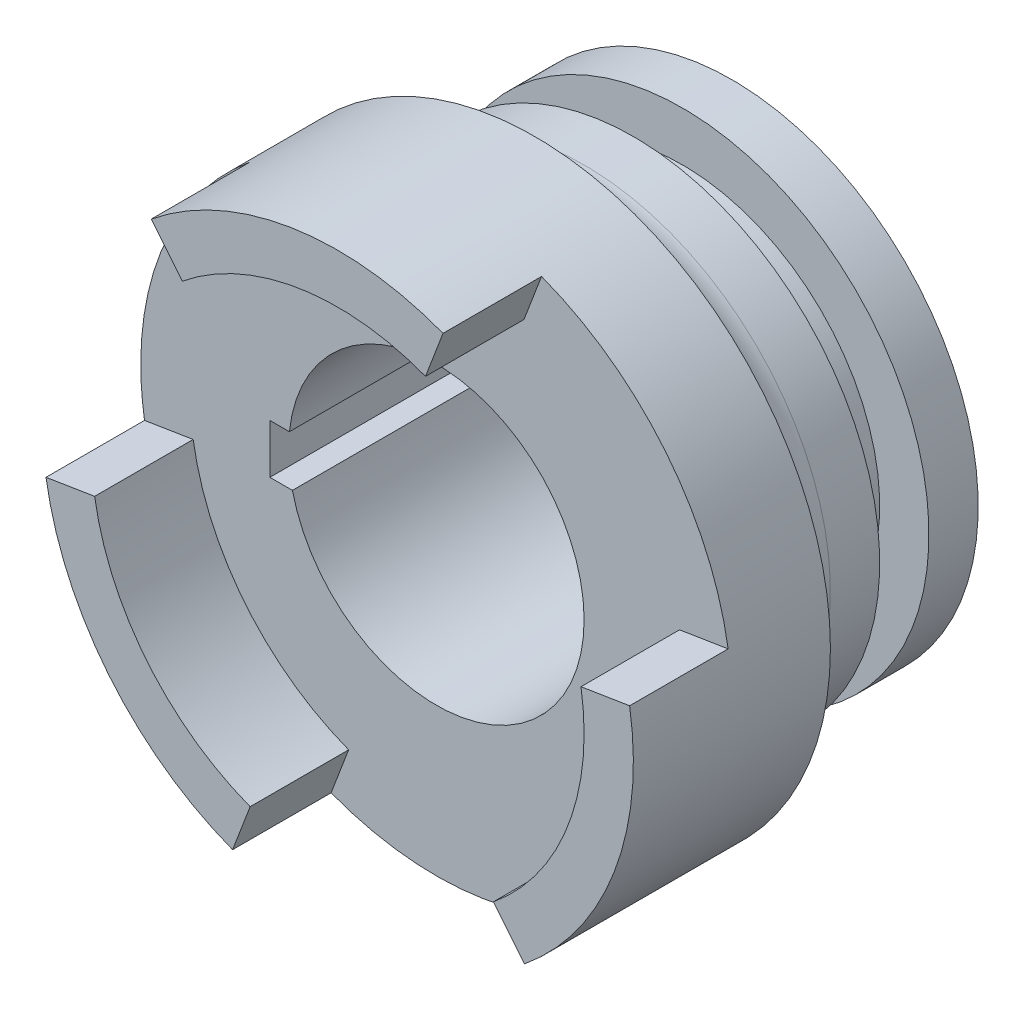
SolidWorks part; units mm, degrees
ref_plane "Front Plane" through (0, 0, 0) normal (0, 0, 1) x (1, 0, 0)
ref_plane "Top Plane" through (0, 0, 0) normal (0, 1, 0) x (1, 0, 0)
ref_plane "Right Plane" through (0, 0, 0) normal (1, 0, 0) x (0, 0, -1)
sketch "Sketch1" plane through (0, 0, 0) normal (0, 0, 1) x (1, 0, 0)
  line L0 (0, 0) -> (-18.9392, 23.266) construction
  line L1 (0, 0) -> (10.6793, 28.0348) construction
  line L2 (-18.9392, 23.266) -> (-15.7827, 19.3883)
  line L3 (10.6793, 28.0348) -> (8.8994, 23.3624)
  line L4 (29.6185, 4.7689) -> (24.6821, 3.974)
  line L5 (18.9392, -23.266) -> (15.7827, -19.3883)
  line L6 (-10.6793, -28.0348) -> (-8.8994, -23.3624)
  line L7 (-29.6185, -4.7689) -> (-24.6821, -3.974)
  arc A0 (10.6793, 28.0348) -> (-18.9392, 23.266) centre (0, 0) ccw
  circle A1 centre (0, 0) radius 25 construction
  arc A2 (-15.7827, 19.3883) -> (8.8994, 23.3624) centre (0, 0) cw
  circle A3 centre (0, 0) radius 30 construction
  arc A4 (24.6821, 3.974) -> (15.7827, -19.3883) centre (0, 0) cw
  arc A5 (18.9392, -23.266) -> (29.6185, 4.7689) centre (0, 0) ccw
  arc A6 (-8.8994, -23.3624) -> (-24.6821, -3.974) centre (0, 0) cw
  arc A7 (-29.6185, -4.7689) -> (-10.6793, -28.0348) centre (0, 0) ccw
  point P21 (0, 0)
  dimension "D1" = 60
  dimension "D3" = 60
  dimension "D2" = 5
  dimension "D4" = 3
extrude "Boss-Extrude1" add sketch "Sketch1" along normal blind 10
sketch "Sketch2" plane through (0, 0, 0) normal (0, 0, -1) x (-1, 0, 0)
  circle A0 centre (0, 0) radius 30
  dimension "D1" = 60
extrude "Boss-Extrude2" add sketch "Sketch2" along normal blind 10
sketch "Sketch3" plane through (0, 0, -10) normal (0, 0, -1) x (-1, 0, 0)
  circle A0 centre (0, 0) radius 25
  dimension "D1" = 50
extrude "Boss-Extrude3" add sketch "Sketch3" along normal blind 10
fillet "Fillet1" radius 5 1 edges at (-25, 0, -10)
sketch "Sketch4" plane through (0, 0, -20) normal (0, 0, -1) x (-1, 0, 0)
  circle A0 centre (0, 0) radius 20
  dimension "D1" = 40
extrude "Boss-Extrude4" add sketch "Sketch4" along normal blind 5
sketch "Sketch5" plane through (0, 0, -25) normal (0, 0, -1) x (-1, 0, 0)
  circle A0 centre (0, 0) radius 25
  dimension "D1" = 50
extrude "Boss-Extrude5" add sketch "Sketch5" along normal blind 5
sketch "Sketch6" plane through (0, 0, -30) normal (0, 0, -1) x (-1, 0, 0)
  line L1 (14.9154, 1.5909) -> (16.8953, 1.5909)
  line L3 (14.6075, -3.4091) -> (16.8953, -3.4091)
  line L4 (16.8953, 1.5909) -> (16.8953, -3.4091)
  arc A0 (14.9154, 1.5909) -> (14.6075, -3.4091) centre (0, 0) ccw
  point P3 (15, 0)
  dimension "D1" = 30
  dimension "D2" = 5
  dimension "D3" = 2.2879
extrude "Cut-Extrude1" cut sketch "Sketch6" against normal through all
move or copy body "Body-Move/Copy1" bodies to move or copy 108 copy no translate (-18.1238, -40.253, 51.981)
move or copy body "Body-Move/Copy2" bodies to move or copy 109 copy yes number of copies 1 translate (2.2323, -101.9164, 0)
other "Save Bodies1"
